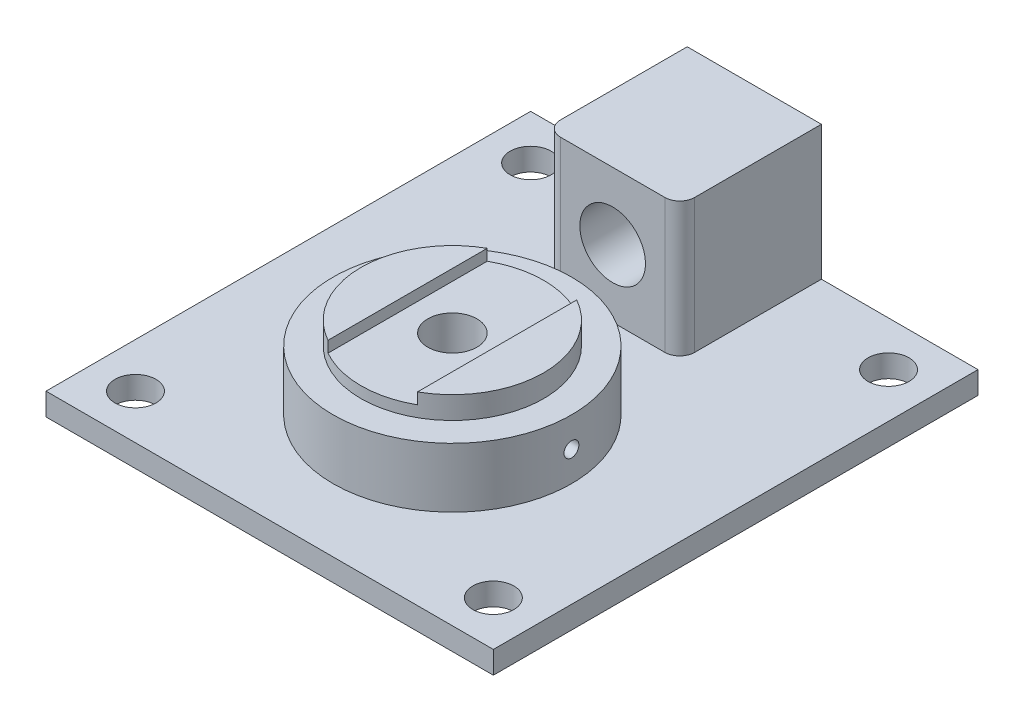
SolidWorks part; units mm, degrees
ref_plane "Ebene vorne" through (0, 0, 0) normal (0, 0, 1) x (1, 0, 0)
ref_plane "Ebene oben" through (0, 0, 0) normal (0, 1, 0) x (1, 0, 0)
ref_plane "Ebene rechts" through (0, 0, 0) normal (1, 0, 0) x (0, 0, -1)
sketch "Skizze1" plane through (0, 0, 0) normal (0, 1, 0) x (1, 0, 0)
  line L1 (-25.177, 37.7825) -> (34.823, 37.7825)
  line L2 (-25.177, 37.7825) -> (-25.177, -27.2175)
  line L3 (-25.177, -27.2175) -> (34.823, -27.2175)
  line L4 (34.823, 37.7825) -> (34.823, -27.2175)
  dimension "D1" = 60
  dimension "D2" = 65
extrude "Linear austragen1" add sketch "Skizze1" along normal blind 3
sketch "Skizze3" plane through (0, 3, 0) normal (0, 1, 0) x (1, 0, 0)
  line L0 (34.823, -27.2175) -> (34.823, 37.7825) construction
  line L1 (34.823, 37.7825) -> (-25.177, 37.7825) construction
  circle A0 centre (4.823, -2.7175) radius 16
  point P6 (4.823, 37.7825)
  dimension "D3" = 32
  dimension "D1" = 30
  dimension "D2" = 40.5
extrude "Linear austragen2" add sketch "Skizze3" along normal blind 8
sketch "Skizze8" plane through (0, 11, 0) normal (0, 1, 0) x (1, 0, 0)
  circle A0 centre (4.823, -2.7175) radius 12.25
  dimension "D1" = 24.5
extrude "Linear austragen4" add sketch "Skizze8" along normal blind 3
sketch "Skizze10" plane through (0, 14, 0) normal (0, 1, 0) x (1, 0, 0)
  line L0 (-1.177, 7.9625) -> (-1.177, -13.3975)
  line L1 (10.823, 7.9625) -> (10.823, -13.3975)
  circle A0 centre (4.823, -2.7175) radius 12.25 construction
  circle A1 centre (4.823, -2.7175) radius 12.25 construction
  arc A2 (-1.177, 7.9625) -> (10.823, 7.9625) centre (4.823, -2.7175) cw
  arc A3 (-1.177, -13.3975) -> (10.823, -13.3975) centre (4.823, -2.7175) ccw
  dimension "D1" = 6
  dimension "D2" = 12
extrude "Linear austragen6" cut sketch "Skizze10" against normal blind 1.5
hole_wizard "Stirnsenkung für M6 Senkschraube (Kopf Button)1" positions "3D-Skizze5" profile "Skizze17" counterbore size "M6" standard "Ansi Metrisch"
sketch3d "3D-Skizze5"
  line L0 (34.823, 0, -37.7825) -> (-25.177, 0, -37.7825) construction
  line L3 (34.823, 0, 27.2175) -> (34.823, 0, -37.7825) construction
  point P0 (4.823, 0, 2.7175)
  dimension "D1" = 40.5
  dimension "D2" = 30
sketch "Skizze17" plane through (4.823, 0, 2.7175) normal (1, 0, 0) x (0, 0, -1)
  line L0 (0, 0) -> (0, 14)
  line L1 (0, 14) -> (3.3, 14)
  line L3 (3.3, 14) -> (3.3, 3.3)
  line L4 (3.3, 3.3) -> (5.75, 3.3)
  line L5 (5.75, 3.3) -> (5.75, 0)
  line L7 (5.75, 0) -> (0, 0)
  line L11 (0, -6.35) -> (0, 107.95) construction
  dimension "Bohrerdurchmesser" = 6.6
  dimension "Bohrungstiefe" = 14
  dimension "Senkdurchmesser2" = 11.5
  dimension "Senktiefe2" = 3.3
sketch "Skizze18" plane through (0, 3, 0) normal (0, 1, 0) x (1, 0, 0)
  line L0 (34.823, -27.2175) -> (34.823, 37.7825) construction
  line L1 (-4.177, 18.7825) -> (13.823, 18.7825)
  line L2 (-4.177, 18.7825) -> (-4.177, 37.7825)
  line L3 (-4.177, 37.7825) -> (13.823, 37.7825)
  line L4 (13.823, 18.7825) -> (13.823, 37.7825)
  line L5 (-4.177, 18.7825) -> (13.823, 37.7825) construction
  line L6 (-4.177, 37.7825) -> (13.823, 18.7825) construction
  circle A0 centre (4.823, -2.7175) radius 16 construction
  point P0 (4.823, 28.2825)
  dimension "D1" = 21.5
  dimension "D2" = 19
  dimension "D3" = 18
  dimension "D4" = 30
extrude "Linear austragen8" add sketch "Skizze18" along normal blind 18
hole_wizard "M10x1.25 Gewindebohrung2" positions "3D-Skizze6" profile "Skizze19" tap size "M10x1.25" standard "Ansi Metrisch"
sketch3d "3D-Skizze6"
  line L0 (-4.177, 3, -37.7825) -> (-25.177, 3, -37.7825) construction
  line L1 (-4.177, 21, -37.7825) -> (-4.177, 3, -37.7825) construction
  point P0 (4.823, 12, -37.7825)
  dimension "D1" = 9
  dimension "D2" = 9
sketch "Skizze19" plane through (4.823, 12, -37.7825) normal (1, 0, 0) x (0, 1, 0)
  line L0 (0, 0) -> (0, 19)
  line L1 (0, 19) -> (4.4, 19)
  line L2 (4.4, 19) -> (4.4, 0)
  line L5 (4.4, 0) -> (0, 0)
  line L11 (0, -6.35) -> (0, 107.95) construction
  dimension "Bohrerdurchmesser" = 8.8
  dimension "Bohrungstiefe" = 19
sketch "Skizze21" plane through (0, 3, 0) normal (0, 1, 0) x (1, 0, 0)
  line L0 (-25.177, -27.2175) -> (34.823, -27.2175) construction
  line L2 (34.823, -27.2175) -> (34.823, 37.7825) construction
  line L3 (-25.177, 37.7825) -> (-25.177, -27.2175) construction
  line L4 (-4.177, 37.7825) -> (-25.177, 37.7825) construction
  line L5 (34.823, 37.7825) -> (13.823, 37.7825) construction
  circle A0 centre (28.823, -21.2175) radius 2.75
  circle A1 centre (4.823, -2.7175) radius 16 construction
  circle A2 centre (-19.177, -21.2175) radius 2.75
  circle A3 centre (-19.177, 31.7825) radius 2.75
  circle A4 centre (28.823, 31.7825) radius 2.75
  dimension "D1" = 5.5
  dimension "D3" = 6
  dimension "D4" = 30.3026
  dimension "D5" = 5.5
  dimension "D6" = 6
  dimension "D7" = 6
  dimension "D8" = 5.5
  dimension "D9" = 6
  dimension "D10" = 6
  dimension "D11" = 5.5
  dimension "D12" = 6
  dimension "D13" = 6
  dimension "D2" = 6
extrude "Linear austragen9" cut sketch "Skizze21" against normal through all
fillet "Verrundung1" radius 2 2 edges at (-4.177, 12, -18.7825) (13.823, 12, -18.7825)
sketch "Skizze22" plane through (0, 0, 0) normal (1, 0, 0) x (0, 0, -1)
  line L0 (13.2825, 11) -> (-18.7175, 11) construction
  line L1 (-18.7175, 11) -> (-18.7175, 3) construction
  circle A0 centre (-2.7175, 7) radius 1
  dimension "D2" = 2
  dimension "D3" = 16
  dimension "D1" = 4
extrude "Linear austragen10" cut sketch "Skizze22" against normal through all and the other way through all
